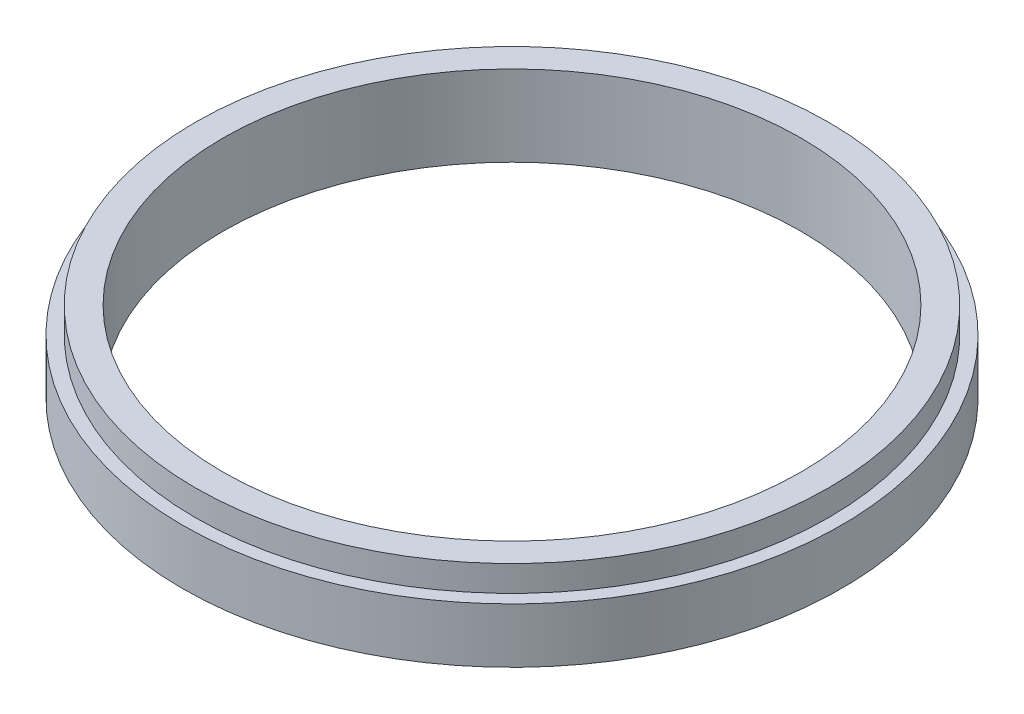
SolidWorks part; units mm, degrees
ref_plane "Front Plane" through (0, 0, 0) normal (0, 0, 1) x (1, 0, 0)
ref_plane "Top Plane" through (0, 0, 0) normal (0, 1, 0) x (1, 0, 0)
ref_plane "Right Plane" through (0, 0, 0) normal (1, 0, 0) x (0, 0, -1)
sketch "Sketch1" plane through (0, 0, 0) normal (0, 1, 0) x (1, 0, 0)
  circle A0 centre (0, 0) radius 25.5
  dimension "D1" = 51
extrude "Boss-Extrude1" add sketch "Sketch1" along normal blind 4.25
sketch "Sketch2" plane through (0, 4.25, 0) normal (0, 1, 0) x (1, 0, 0)
  circle A0 centre (0, 0) radius 24.5
  dimension "D1" = 49
extrude "Boss-Extrude2" add sketch "Sketch2" along normal blind 2
sketch "Sketch3" plane through (0, 0, 0) normal (0, -1, 0) x (1, 0, 0)
  circle A0 centre (0, 0) radius 22.375
  dimension "D1" = 44.75
extrude "Cut-Extrude1" cut sketch "Sketch3" against normal through all
